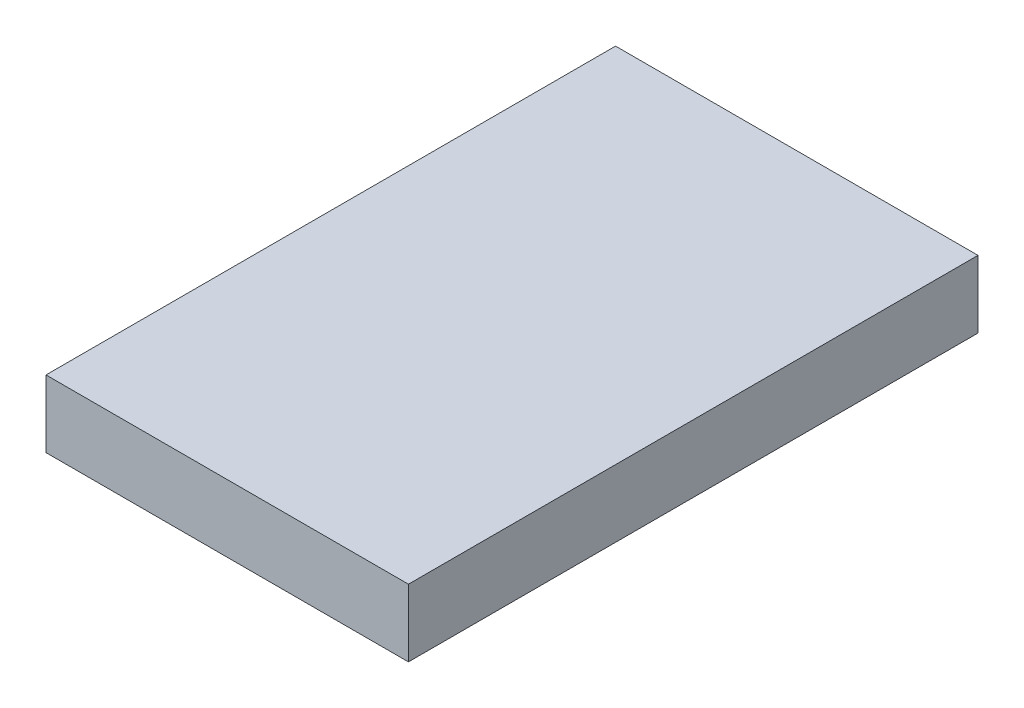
SolidWorks part; units mm, degrees
ref_plane "Alzado" through (0, 0, 0) normal (0, 0, 1) x (1, 0, 0)
ref_plane "Planta" through (0, 0, 0) normal (0, 1, 0) x (1, 0, 0)
ref_plane "Vista lateral" through (0, 0, 0) normal (1, 0, 0) x (0, 0, -1)
sketch "Croquis1" plane through (0, 0, 0) normal (0, 1, 0) x (1, 0, 0)
  line L0 (-35, 55) -> (35, -55) construction
  line L1 (-35, 55) -> (35, 55)
  line L2 (-35, 55) -> (-35, -55)
  line L3 (-35, -55) -> (35, -55)
  line L4 (35, 55) -> (35, -55)
  dimension "D1" = 70
  dimension "D2" = 110
extrude "Extruir1" add sketch "Croquis1" along normal blind 13
